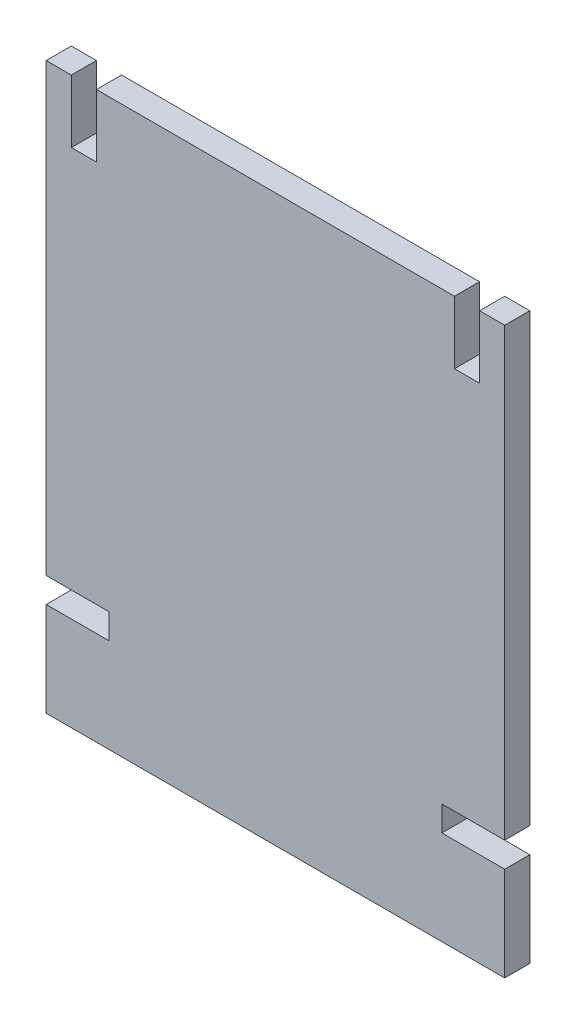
SolidWorks part; units mm, degrees
ref_plane "Front Plane" through (0, 0, 0) normal (0, 0, 1) x (1, 0, 0)
ref_plane "Top Plane" through (0, 0, 0) normal (0, 1, 0) x (1, 0, 0)
ref_plane "Right Plane" through (0, 0, 0) normal (1, 0, 0) x (0, 0, -1)
sketch "Sketch1" plane through (0, 0, 0) normal (0, 0, 1) x (1, 0, 0)
  line L0 (-28.5, 45) -> (28.5, 45)
  line L1 (-36.5, 45) -> (-32.5, 45)
  line L2 (-36.5, 45) -> (-36.5, -26)
  line L3 (-36.5, -45) -> (36.5, -45)
  line L4 (36.5, 45) -> (36.5, -26)
  line L5 (-36.5, 45) -> (36.5, -45) construction
  line L6 (-36.5, -45) -> (36.5, 45) construction
  line L7 (32.5, 45) -> (36.5, 45)
  line L8 (-32.5, 45) -> (-32.5, 35)
  line L9 (-32.5, 35) -> (-28.5, 35)
  line L10 (-28.5, 45) -> (-28.5, 35)
  line L11 (-36.5, -30) -> (-36.5, -45)
  line L12 (28.5, 45) -> (28.5, 35)
  line L13 (28.5, 35) -> (32.5, 35)
  line L14 (32.5, 45) -> (32.5, 35)
  line L15 (-36.5, -26) -> (-26.5, -26)
  line L16 (36.5, -30) -> (36.5, -45)
  line L17 (-36.5, -30) -> (-26.5, -30)
  line L18 (-26.5, -26) -> (-26.5, -30)
  line L19 (36.5, -26) -> (26.5, -26)
  line L21 (36.5, -30) -> (26.5, -30)
  line L22 (26.5, -26) -> (26.5, -30)
  point P0 (0, 0)
  dimension "D1" = 73
  dimension "D2" = 90
  dimension "D3" = 4
  dimension "D4" = 4
  dimension "D5" = 4
  dimension "D6" = 4
  dimension "D7" = 10
  dimension "D8" = 10
  dimension "D9" = 15
  dimension "D10" = 4
  dimension "D11" = 4
  dimension "D12" = 15
  dimension "D13" = 10
  dimension "D14" = 10
extrude "Extrude1" add sketch "Sketch1" along normal blind 4
